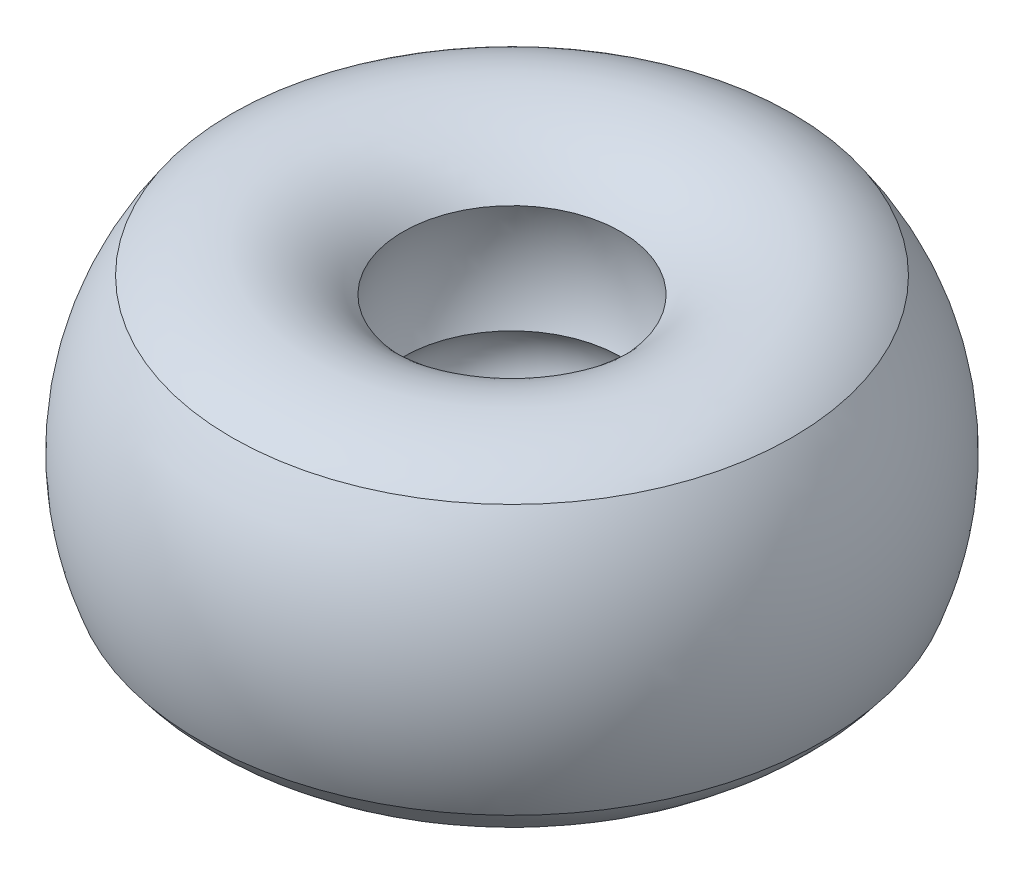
SolidWorks part; units mm, degrees
ref_plane "Piano1 (Front/Back)" through (0, 0, 0) normal (0, 0, 1) x (1, 0, 0)
ref_plane "Piano2 (Top/Bottom)" through (0, 0, 0) normal (0, 1, 0) x (1, 0, 0)
ref_plane "Piano3 (Left/Right)" through (0, 0, 0) normal (1, 0, 0) x (0, 0, -1)
sketch "Pos.Calibrazione" plane through (0, 0, 0) normal (0, 0, 1) x (1, 0, 0)
  line L0 (0, 0) -> (0, 750) construction
  line L1 (0, 750) -> (-400, 750) construction
  line L2 (-400, 750) -> (-400, 1925) construction
  line L3 (-400, 1925) -> (-1760, 1925) construction
  line L4 (-1760, 1925) -> (-2010, 1925) construction
  line L5 (-2010, 1925) -> (-2010, 1675) construction
  line L6 (-400, 750) -> (-51.3319, 719.4955) construction
  line L7 (-51.3319, 719.4955) -> (-51.3319, 1894.4955) construction
  line L8 (-51.3319, 1894.4955) -> (-400, 1925) construction
  line L9 (-400, 1925) -> (-400, 2025) construction
  dimension "D1" = 250
  dimension "D2" = 250
  dimension "D3" = 750
  dimension "D4" = 400
  dimension "D5" = 350
  dimension "D6" = 5
  dimension "D7" = 1175
  dimension "D8" = 1360
  dimension "D9" = 100
  dimension "D10" = 90
sketch "Pos.1" plane through (0, 0, 0) normal (0, 0, 1) x (1, 0, 0)
  line L0 (0, 0) -> (0, 750) construction
  line L1 (0, 750) -> (-400, 750) construction
  line L2 (-400, 750) -> (-65.2933, 852.3301) construction
  line L3 (-400, 750) -> (-51.3319, 719.4955) construction
  line L4 (-400, 750) -> (486.7838, 1520.8694) construction
  line L5 (-65.2933, 852.3301) -> (821.4904, 1623.1995) construction
  line L6 (821.4904, 1623.1995) -> (486.7838, 1520.8694) construction
  line L7 (-400, 750) -> (-400, 1925) construction
  line L8 (486.7838, 1520.8694) -> (-774.1863, 1011.4044) construction
  line L9 (-400, 1925) -> (-1760, 1925) construction
  line L10 (-774.1863, 1011.4044) -> (-1024.1863, 1011.4044) construction
  line L11 (-1024.1863, 1011.4044) -> (-1024.1863, 761.4044) construction
  line L12 (-1760, 1925) -> (-2010, 1925) construction
  line L13 (-2010, 1925) -> (-2010, 1675) construction
  line L14 (486.7838, 1520.8694) -> (486.7838, 1620.8694) construction
  line L15 (-400, 1925) -> (-400, 2025) construction
  line L16 (-400, 750) -> (-400, 650) construction
  line L17 (-400, 750) -> (-307.2816, 787.4607) construction
  dimension "D1" = 5
  dimension "D2" = 49
  dimension "D3" = 112
  dimension "D5" = 5
sketch "Pos.1-2" plane through (0, 0, 0) normal (0, 0, 1) x (1, 0, 0)
  line L0 (0, 0) -> (0, 750) construction
  line L1 (0, 750) -> (-400, 750) construction
  line L2 (-400, 750) -> (486.7838, 1520.8694) construction
  line L3 (-400, 750) -> (-51.3319, 719.4955) construction
  line L4 (-51.3319, 719.4955) -> (835.4519, 1490.3648) construction
  line L5 (835.4519, 1490.3648) -> (486.7838, 1520.8694) construction
  line L6 (486.7838, 1520.8694) -> (-873.2162, 1520.8694) construction
  line L7 (-873.2162, 1520.8694) -> (-1123.2162, 1520.8694) construction
  line L8 (-1123.2162, 1520.8694) -> (-1123.2162, 1270.8694) construction
  line L9 (486.7838, 1520.8694) -> (486.7838, 1620.8694) construction
  line L10 (-400, 1925) -> (-400, 2025) construction
  line L11 (-400, 750) -> (-51.3319, 719.4955) construction
  line L12 (-400, 750) -> (-400, 1925) construction
  line L13 (-400, 1925) -> (-1760, 1925) construction
  line L14 (-1760, 1925) -> (-2010, 1925) construction
  line L15 (-2010, 1925) -> (-2010, 1675) construction
  dimension "D1" = 5
  dimension "D2" = 49
  dimension "D3" = 90
sketch "Pos.2" plane through (0, 0, 0) normal (0, 0, 1) x (1, 0, 0)
  line L0 (0, 0) -> (0, 750) construction
  line L1 (0, 750) -> (-400, 750) construction
  line L2 (-400, 750) -> (486.7838, 1520.8694) construction
  line L3 (-400, 750) -> (-88.1477, 591.1033) construction
  line L4 (-88.1477, 591.1033) -> (798.636, 1361.9727) construction
  line L5 (798.636, 1361.9727) -> (486.7838, 1520.8694) construction
  line L6 (486.7838, 1520.8694) -> (-774.1863, 2030.3343) construction
  line L7 (-774.1863, 2030.3343) -> (-1024.1863, 2030.3343) construction
  line L8 (-1024.1863, 2030.3343) -> (-1024.1863, 1780.3343) construction
  line L9 (486.7838, 1520.8694) -> (486.7838, 1620.8694) construction
  line L10 (-400, 750) -> (-51.3319, 719.4955) construction
  line L11 (-400, 750) -> (-400, 1925) construction
  line L12 (-400, 1925) -> (-400, 2025) construction
  line L13 (-400, 1925) -> (-1760, 1925) construction
  line L14 (-1760, 1925) -> (-2010, 1925) construction
  line L15 (-2010, 1925) -> (-2010, 1675) construction
  line L16 (-400, 750) -> (-307.2816, 712.5393) construction
  dimension "D1" = 5
  dimension "D2" = 49
  dimension "D3" = 68
  dimension "D4" = 5
sketch "Pos.2-3" plane through (0, 0, 0) normal (0, 0, 1) x (1, 0, 0)
  line L0 (0, 0) -> (0, 750) construction
  line L1 (0, 750) -> (-400, 750) construction
  line L2 (-400, 750) -> (-287.3812, 1919.5905) construction
  line L3 (-400, 750) -> (-88.1477, 591.1033) construction
  line L4 (-88.1477, 591.1033) -> (24.471, 1760.6939) construction
  line L5 (24.471, 1760.6939) -> (-287.3812, 1919.5905) construction
  line L6 (-287.3812, 1919.5905) -> (-1548.3513, 2429.0555) construction
  line L7 (-1548.3513, 2429.0555) -> (-1798.3513, 2429.0555) construction
  line L8 (-1798.3513, 2429.0555) -> (-1798.3513, 2179.0555) construction
  line L9 (-287.3812, 1919.5905) -> (-287.3812, 2019.5905) construction
  line L10 (-400, 1925) -> (-400, 2025) construction
  line L11 (-1760, 1925) -> (-2010, 1925) construction
  line L12 (-2010, 1925) -> (-2010, 1675) construction
  line L13 (-400, 1925) -> (-1760, 1925) construction
  line L14 (-400, 750) -> (-51.3319, 719.4955) construction
  line L15 (-400, 750) -> (-400, 1925) construction
  dimension "D1" = 5
  dimension "D2" = 68
  dimension "D3" = 5.5
sketch "Pos.3" plane through (0, 0, 0) normal (0, 0, 1) x (1, 0, 0)
  line L0 (0, 0) -> (0, 750) construction
  line L1 (0, 750) -> (-400, 750) construction
  line L2 (-400, 750) -> (-88.1477, 591.1033) construction
  line L3 (-88.1477, 591.1033) -> (-811.55, 1517.016) construction
  line L4 (-811.55, 1517.016) -> (-1123.4022, 1675.9126) construction
  line L5 (-1123.4022, 1675.9126) -> (-400, 750) construction
  line L6 (-1123.4022, 1675.9126) -> (-1123.4022, 1819.034) construction
  line L7 (-1123.4022, 1675.9126) -> (-2384.3723, 2185.3776) construction
  line L8 (-2384.3723, 2185.3776) -> (-2634.3723, 2185.3776) construction
  line L9 (-2634.3723, 2185.3776) -> (-2634.3723, 1935.3776) construction
  line L10 (-400, 750) -> (-51.3319, 719.4955) construction
  line L11 (-400, 750) -> (-400, 1925) construction
  line L12 (-400, 1925) -> (-1760, 1925) construction
  line L13 (-1760, 1925) -> (-2010, 1925) construction
  line L14 (-2010, 1925) -> (-2010, 1675) construction
  line L15 (-400, 750) -> (-307.2816, 712.5393) construction
  line L16 (-400, 1925) -> (-400, 2025) construction
  dimension "D1" = 5
  dimension "D2" = 38
  dimension "D3" = 68
  dimension "D4" = 155
  dimension "D5" = 5
sketch "Pos.3-4" plane through (0, 0, 0) normal (0, 0, 1) x (1, 0, 0)
  line L0 (0, 0) -> (0, 750) construction
  line L1 (0, 750) -> (-400, 750) construction
  line L2 (-400, 750) -> (-1477.5456, 1218.5302) construction
  line L3 (-400, 750) -> (-50.1199, 759.1619) construction
  line L4 (-50.1199, 759.1619) -> (-1127.6655, 1227.6921) construction
  line L5 (-1127.6655, 1227.6921) -> (-1477.5456, 1218.5302) construction
  line L6 (-1477.5456, 1218.5302) -> (-1477.5456, 1318.5302) construction
  line L7 (-1477.5456, 1218.5302) -> (-2828.8033, 1064.5738) construction
  line L8 (-2828.8033, 1064.5738) -> (-3078.8033, 1064.5738) construction
  line L9 (-3078.8033, 1064.5738) -> (-3078.8033, 814.5738) construction
  line L10 (-400, 750) -> (-51.3319, 719.4955) construction
  line L11 (-400, 750) -> (-400, 1925) construction
  line L12 (-400, 1925) -> (-1760, 1925) construction
  line L13 (-1760, 1925) -> (-2010, 1925) construction
  line L14 (-2010, 1925) -> (-2010, 1675) construction
  line L15 (-400, 1925) -> (-400, 2025) construction
  dimension "D1" = 5
  dimension "D2" = 66.5
  dimension "D3" = 155
  dimension "D4" = 96.5
sketch "Pos.4" plane through (0, 0, 0) normal (0, 0, 1) x (1, 0, 0)
  line L0 (0, 0) -> (0, 750) construction
  line L1 (0, 750) -> (-400, 750) construction
  line L2 (-400, 750) -> (-1570.5288, 647.592) construction
  line L3 (-1570.5288, 647.592) -> (-2684.5756, -132.472) construction
  line L4 (-2684.5756, -132.472) -> (-2934.5756, -132.472) construction
  line L5 (-2934.5756, -132.472) -> (-2934.5756, -382.472) construction
  line L6 (-1570.5288, 647.592) -> (-1570.5288, 747.592) construction
  line L7 (-1570.5288, 647.592) -> (-1267.4199, 822.592) construction
  line L8 (-1267.4199, 822.592) -> (-96.8911, 925) construction
  line L9 (-96.8911, 925) -> (-400, 750) construction
  line L10 (-2010, 1925) -> (-2010, 1675) construction
  line L11 (-1760, 1925) -> (-2010, 1925) construction
  line L12 (-400, 1925) -> (-1760, 1925) construction
  line L13 (-400, 1925) -> (-400, 2025) construction
  line L14 (-400, 750) -> (-51.3319, 719.4955) construction
  line L15 (-400, 750) -> (-400, 1925) construction
  line L16 (-400, 750) -> (-318.0848, 807.3576) construction
  dimension "D1" = 5
  dimension "D2" = 95
  dimension "D3" = 125
  dimension "D4" = 155
  dimension "D5" = 5
sketch "Pos.4-5" plane through (0, 0, 0) normal (0, 0, 1) x (1, 0, 0)
  line L0 (0, 0) -> (0, 750) construction
  line L1 (0, 750) -> (-400, 750) construction
  line L2 (-400, 750) -> (-1570.5288, 647.592) construction
  line L3 (-400, 750) -> (-400, 1925) construction
  line L4 (-400, 750) -> (-291.8441, 1082.8698) construction
  line L5 (-291.8441, 1082.8698) -> (-1462.3728, 980.4618) construction
  line L6 (-1462.3728, 980.4618) -> (-1570.5288, 647.592) construction
  line L7 (-400, 750) -> (-51.3319, 719.4955) construction
  line L8 (-1570.5288, 647.592) -> (-1876.4622, -677.5513) construction
  line L9 (-400, 1925) -> (-1760, 1925) construction
  line L10 (-1876.4622, -677.5513) -> (-2126.4622, -677.5513) construction
  line L11 (-2126.4622, -677.5513) -> (-2126.4622, -927.5513) construction
  line L12 (-1760, 1925) -> (-2010, 1925) construction
  line L13 (-2010, 1925) -> (-2010, 1675) construction
  line L14 (-1570.5288, 647.592) -> (-1570.5288, 747.592) construction
  line L15 (-400, 1925) -> (-400, 2025) construction
  dimension "D1" = 95
  dimension "D2" = 5
  dimension "D3" = 167
sketch "Pos.5" plane through (0, 0, 0) normal (0, 0, 1) x (1, 0, 0)
  line L0 (0, 0) -> (0, 750) construction
  line L1 (0, 750) -> (-400, 750) construction
  line L2 (-400, 750) -> (-1570.5288, 647.592) construction
  line L3 (-1570.5288, 647.592) -> (-932.0474, -553.2167) construction
  line L4 (-932.0474, -553.2167) -> (-1182.0474, -553.2167) construction
  line L5 (-1182.0474, -553.2167) -> (-1182.0474, -803.2167) construction
  line L6 (-400, 750) -> (-400, 1925) construction
  line L7 (-400, 1925) -> (-1760, 1925) construction
  line L8 (-1760, 1925) -> (-2010, 1925) construction
  line L9 (-2010, 1925) -> (-2010, 1675) construction
  line L10 (-1570.5288, 647.592) -> (-1707.2847, 969.7687) construction
  line L11 (-1707.2847, 969.7687) -> (-536.7559, 1072.1767) construction
  line L12 (-536.7559, 1072.1767) -> (-400, 750) construction
  line L13 (-400, 750) -> (-51.3319, 719.4955) construction
  line L14 (-1570.5288, 647.592) -> (-1570.5288, 747.592) construction
  line L15 (-400, 1925) -> (-400, 2025) construction
  line L16 (-400, 750) -> (-446.9472, 838.2948) construction
  dimension "D1" = 5
  dimension "D2" = 95
  dimension "D3" = 208
  dimension "D4" = 5
sketch "Pos.5-6" plane through (0, 0, 0) normal (0, 0, 1) x (1, 0, 0)
  line L0 (0, 0) -> (0, 750) construction
  line L1 (0, 750) -> (-400, 750) construction
  line L2 (-400, 750) -> (-536.7559, 1072.1767) construction
  line L3 (-536.7559, 1072.1767) -> (-1647.7402, 1454.7193) construction
  line L4 (-1647.7402, 1454.7193) -> (-1510.9843, 1132.5426) construction
  line L5 (-1510.9843, 1132.5426) -> (-400, 750) construction
  line L6 (-1510.9843, 1132.5426) -> (-1510.9843, 1232.5426) construction
  line L7 (-1510.9843, 1132.5426) -> (-872.503, -68.2661) construction
  line L8 (-872.503, -68.2661) -> (-1122.503, -68.2661) construction
  line L9 (-1122.503, -68.2661) -> (-1122.503, -318.2661) construction
  line L10 (-400, 750) -> (-51.3319, 719.4955) construction
  line L11 (-400, 750) -> (-400, 1925) construction
  line L12 (-400, 1925) -> (-400, 2025) construction
  line L13 (-400, 1925) -> (-1760, 1925) construction
  line L14 (-1760, 1925) -> (-2010, 1925) construction
  line L15 (-2010, 1925) -> (-2010, 1675) construction
  dimension "D1" = 5
  dimension "D2" = 208
  dimension "D3" = 71
sketch "Pos.6" plane through (0, 0, 0) normal (0, 0, 1) x (1, 0, 0)
  line L0 (0, 0) -> (0, 750) construction
  line L1 (0, 750) -> (-400, 750) construction
  line L2 (-400, 750) -> (-1259.3406, 1551.3481) construction
  line L3 (-1259.3406, 1551.3481) -> (-620.8593, 350.5393) construction
  line L4 (-620.8593, 350.5393) -> (-870.8593, 350.5393) construction
  line L5 (-870.8593, 350.5393) -> (-870.8593, 100.5393) construction
  line L6 (-400, 750) -> (-536.7559, 1072.1767) construction
  line L7 (-536.7559, 1072.1767) -> (-1396.0965, 1873.5248) construction
  line L8 (-1396.0965, 1873.5248) -> (-1259.3406, 1551.3481) construction
  line L9 (-1259.3406, 1551.3481) -> (-1259.3406, 1651.3481) construction
  line L10 (-400, 1925) -> (-400, 2025) construction
  line L11 (-1760, 1925) -> (-2010, 1925) construction
  line L12 (-2010, 1925) -> (-2010, 1675) construction
  line L13 (-400, 1925) -> (-1760, 1925) construction
  line L14 (-400, 750) -> (-51.3319, 719.4955) construction
  line L15 (-400, 750) -> (-400, 1925) construction
  line L16 (-400, 750) -> (-446.9472, 838.2948) construction
  dimension "D1" = 5
  dimension "D2" = 208
  dimension "D3" = 24
  dimension "D4" = 47
  dimension "D5" = 5
sketch "Pos.6-1" plane through (0, 0, 0) normal (0, 0, 1) x (1, 0, 0)
  line L0 (0, 0) -> (0, 750) construction
  line L1 (0, 750) -> (-400, 750) construction
  line L2 (-400, 750) -> (-379.4934, 1924.821) construction
  line L3 (-379.4934, 1924.821) -> (-844.6408, 646.8391) construction
  line L4 (-844.6408, 646.8391) -> (-1094.6408, 646.8391) construction
  line L5 (-1094.6408, 646.8391) -> (-1094.6408, 396.8391) construction
  line L6 (-2010, 1925) -> (-2010, 1675) construction
  line L7 (-1760, 1925) -> (-2010, 1925) construction
  line L8 (-400, 1925) -> (-1760, 1925) construction
  line L9 (-400, 750) -> (-1259.3406, 1551.3481) construction
  line L10 (-379.4934, 1924.821) -> (-231.577, 2242.0288) construction
  line L11 (-400, 750) -> (-252.0836, 1067.2077) construction
  line L12 (-252.0836, 1067.2077) -> (-231.577, 2242.0288) construction
  line L13 (-400, 750) -> (-51.3319, 719.4955) construction
  line L14 (-379.4934, 1924.821) -> (-379.4934, 2024.821) construction
  line L15 (-400, 1925) -> (-400, 2025) construction
  line L16 (-400, 750) -> (-400, 1925) construction
  dimension "D1" = 5
  dimension "D2" = 1
  dimension "D3" = 24
  dimension "D4" = 160
sketch "Area Lavoro" plane through (0, 0, 0) normal (0, 0, 1) x (1, 0, 0)
  line L0 (0, 0) -> (0, 750) construction
  line L1 (0, 0) -> (0, 750) construction
  arc A0 (-1024.1863, 761.4044) -> (-1024.1863, 1780.3343) centre (236.7838, 1270.8694) cw
  arc A1 (-1024.1863, 1780.3343) -> (-2634.3723, 1935.3776) centre (-1910.97, 1009.465) ccw
  arc A2 (-2934.5756, -382.472) -> (-2634.3723, 1935.3776) centre (-650, 500) cw
  arc A3 (-2934.5756, -382.472) -> (-1182.0474, -803.2167) centre (-1820.5288, 397.592) ccw
  arc A4 (-1182.0474, -803.2167) -> (-870.8593, 100.5393) centre (-11.5187, -700.8087) cw
  arc A5 (-870.8593, 100.5393) -> (-1024.1863, 761.4044) centre (-650, 500) cw
revolve "Volume area lavoro" add sketch "Area Lavoro" angle 360 about L1
